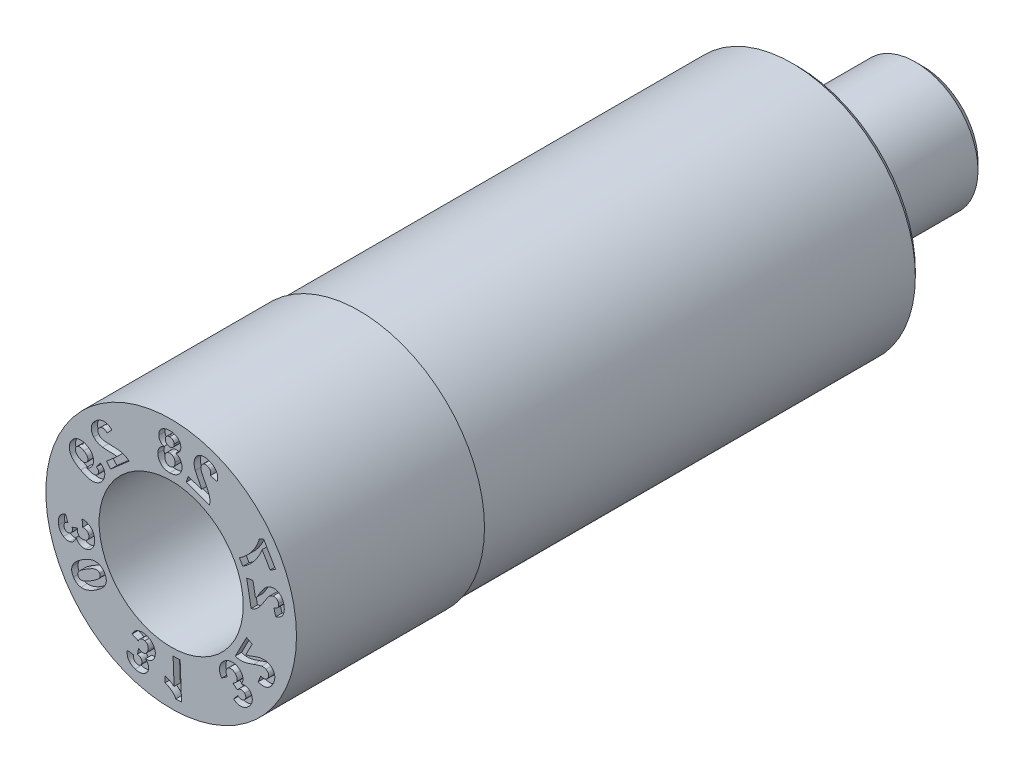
SolidWorks part; units mm, degrees
other "<M4 X .7 SHSS>-<Revolve1>"
ref_plane "Front Plane" through (0, 0, 0) normal (0, 0, 1) x (1, 0, 0)
ref_plane "Top Plane" through (0, 0, 0) normal (0, 1, 0) x (1, 0, 0)
ref_plane "Right Plane" through (0, 0, 0) normal (1, 0, 0) x (0, 0, -1)
sketch "Sketch1" plane through (0, 0, 0) normal (1, 0, 0) x (0, 0, -1)
  line L2 (0, 4) -> (0, 2.3)
  line L3 (19.75, 4) -> (0, 4)
  line L4 (-3.7979, 0) -> (49996.2021, 0) construction
  line L8 (16, 1.25) -> (4, 1.25)
  line L9 (4, 2.3) -> (4, 1.25)
  line L10 (4, 2.3) -> (0, 2.3)
  line L12 (20, 2) -> (20, 3.75)
  line L16 (20, 3.75) -> (19.75, 4)
  line L17 (20, 2) -> (16, 2)
  line L18 (16, 1.25) -> (16, 2)
  dimension "D1" = 20
  dimension "D2" = 45
  dimension "D3" = 0.25
  dimension "D4" = 8
  dimension "D5" = 4.6
  dimension "D6" = 4
  dimension "D7" = 2.5
  dimension "D8" = 4
  dimension "D9" = 4
revolve "Revolve1" add sketch "Sketch1" angle 360 about L4
sketch "Sketch4" plane through (0, 0, 0) normal (1, 0, 0) x (0, 0, -1)
  line L0 (0, 0) -> (50000, 0) construction
  line L1 (20, -3.75) -> (20, 3.75) construction
  line L2 (6, 4.935) -> (20, 4.935)
  line L3 (6, 4.935) -> (6, 3.935)
  line L4 (6, 3.935) -> (20, 3.935)
  line L5 (20, 4.935) -> (20, 3.935)
  line L6 (19.75, 4) -> (0, 4) construction
  line L9 (0, 4.4) -> (0, -4.4) construction
  dimension "D1" = 1
  dimension "D2" = 0.065
  dimension "D3" = 6
revolve "Cut-Revolve1" cut sketch "Sketch4" angle 360 about L0
sketch "Sketch2" plane through (0, 0, 0) normal (0, 0, 1) x (1, 0, 0)
  line L0 (0, 0) -> (0, 4.4713) construction
  line L1 (0, 0) -> (3.8723, 2.2357) construction
  line L2 (0, 0) -> (3.8723, -2.2357) construction
  line L3 (0, 0) -> (0, -4.4713) construction
  line L4 (0, 0) -> (-3.8723, -2.2357) construction
  line L5 (0, 0) -> (-3.8723, 2.2357) construction
  circle A0 centre (0, 0) radius 2.5584 construction
  text T0 "27  28  29  30  31  32" font "Arial" height 1.15
  point P12 (0, 0)
  point P1071 (0, 0.0065)
  point P1072 (0.0065, 0.0065)
  point P1073 (0.0065, 0)
  dimension "D1" = 6
extrude "Cut-Extrude1" cut sketch "Sketch2" against normal blind 0.2
sketch "Sketch3" plane through (0, 0, -4) normal (0, 0, 1) x (1, 0, 0)
  line L0 (0, 0) -> (0, 50000) construction
  line L1 (0.7217, 1.25) -> (-0.7217, 1.25)
  line L2 (-0.7217, 1.25) -> (-1.4434, 0)
  line L3 (-1.4434, 0) -> (-0.7217, -1.25)
  line L4 (-0.7217, -1.25) -> (0.7217, -1.25)
  line L5 (0.7217, -1.25) -> (1.4434, 0)
  line L6 (1.4434, 0) -> (0.7217, 1.25)
  line L7 (0, 0) -> (50000, 0) construction
  circle A0 centre (0, 0) radius 1.25 construction
  circle A1 centre (0, 0) radius 1.25 construction
extrude "Cut-Extrude2" cut sketch "Sketch3" against normal blind 2
inserted part "M4 X .7 SHSS"
move or copy body "Body-Move/Copy2" placed by mates yes
